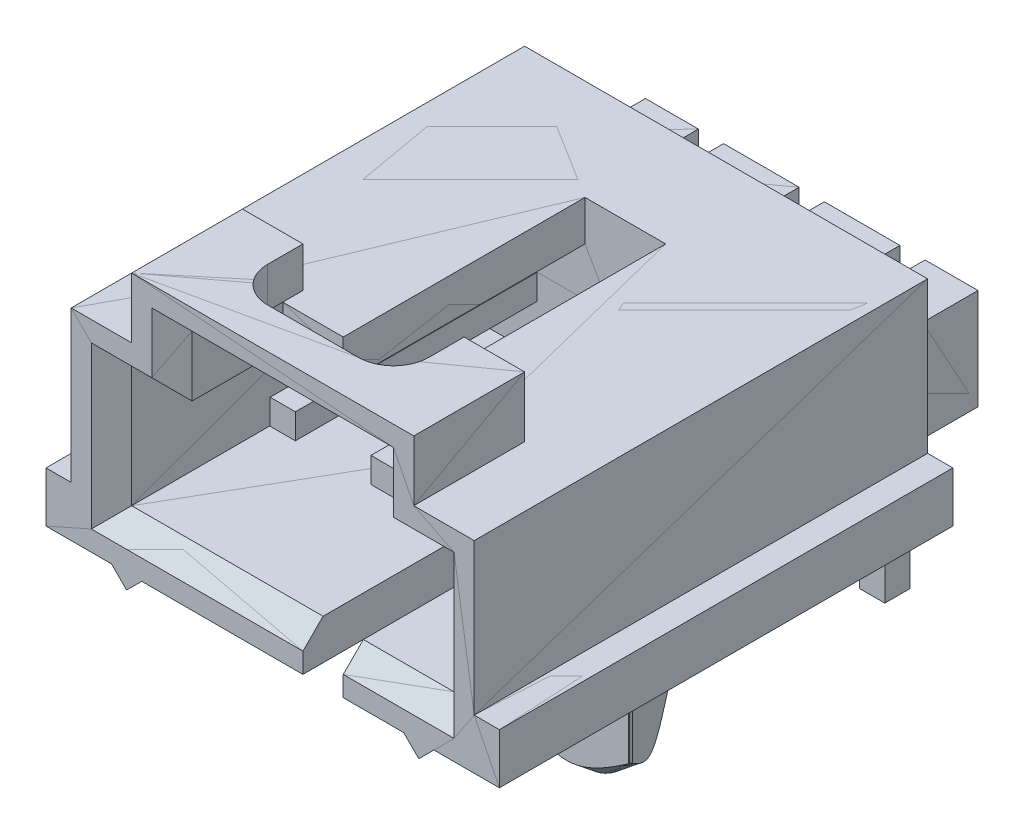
SolidWorks part; units mm, degrees
ref_plane "Front" through (0, 0, 0) normal (0, 0, 1) x (1, 0, 0)
ref_plane "Top" through (0, 0, 0) normal (0, 1, 0) x (1, 0, 0)
ref_plane "Right" through (0, 0, 0) normal (1, 0, 0) x (0, 0, -1)
imported_body "Imported1"
sketch "Sketch1" plane through (0, 0, 0) normal (1, 0, 0) x (0, 0, -1)
  line L0 (5.715, -1.778) -> (7.874, -1.778) construction
  line L1 (6.1724, -1.778) -> (9.0732, -1.778)
  line L2 (6.1724, -1.778) -> (6.1724, -6.4427)
  line L3 (6.1724, -6.4427) -> (9.0732, -6.4427)
  line L4 (9.0732, -1.778) -> (9.0732, -6.4427)
extrude "Cut-Extrude1" cut sketch "Sketch1" against normal through all and the other way through all
